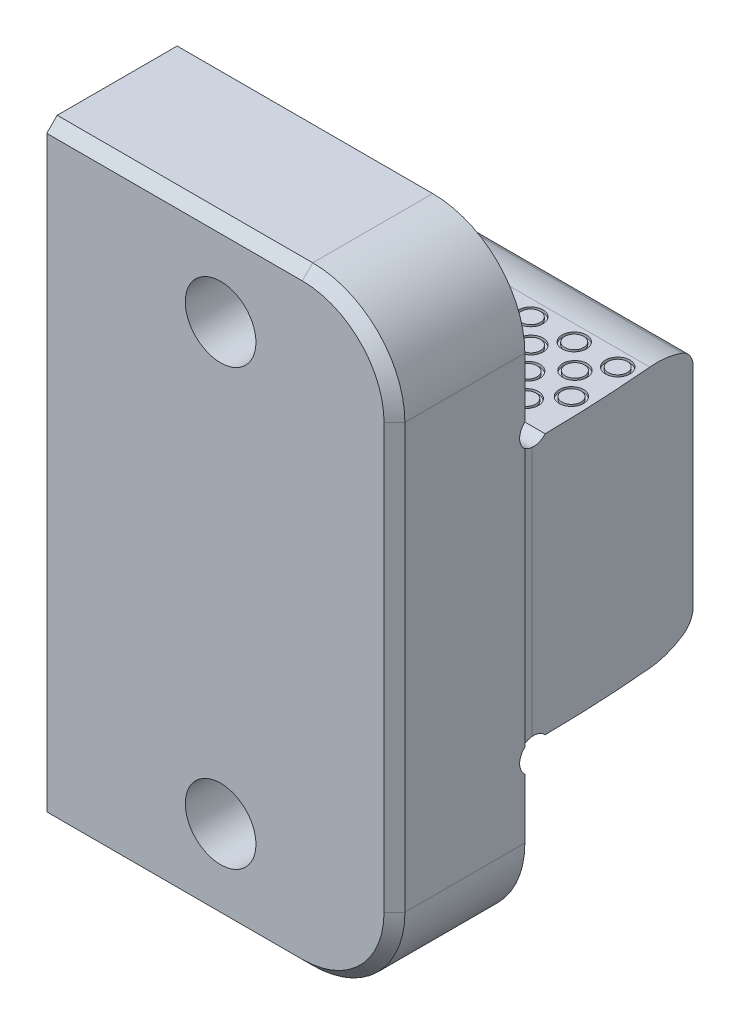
SolidWorks part; units mm, degrees
ref_plane "Front Plane" through (0, 0, 0) normal (0, 0, 1) x (1, 0, 0)
ref_plane "Top Plane" through (0, 0, 0) normal (0, 1, 0) x (1, 0, 0)
ref_plane "Right Plane" through (0, 0, 0) normal (1, 0, 0) x (0, 0, -1)
sketch "Sketch3" plane through (0, 0, 0) normal (1, 0, 0) x (0, 0, -1)
  line L0 (0, 27.94) -> (0, -27.94) construction
  line L1 (-19.05, -44.45) -> (0, -44.45)
  line L2 (-19.05, -44.45) -> (-19.05, 44.45)
  line L3 (-19.05, 44.45) -> (0, 44.45)
  line L4 (26.416, -19.0475) -> (26.416, 19.0475)
  line L6 (0, -44.45) -> (0, -19.0475)
  line L7 (0, -19.0475) -> (26.416, -19.0475)
  line L8 (0, 44.45) -> (0, 19.0475)
  line L9 (0, 19.0475) -> (26.416, 19.0475)
  line L10 (0, 0) -> (50000, 0) construction
  dimension "D1" = 45.466
  dimension "D2" = 19.05
  dimension "D3" = 88.9
  dimension "D4" = 38.0949
extrude "Extrude1" add sketch "Sketch3" along normal mid plane 50.8
sketch "Sketch7" plane through (25.4, 0, 0) normal (1, 0, 0) x (0, 0, -1)
  line L0 (0, 0) -> (50000, 0) construction
  line L1 (0, -25.4) -> (50.8, -25.4)
  line L2 (0, -25.4) -> (0, 25.4)
  line L3 (0, 25.4) -> (50.8, 25.4)
  line L4 (50.8, -25.4) -> (50.8, 25.4)
  line L5 (0, -44.45) -> (0, -19.0475) construction
  dimension "D1" = 50.8
  dimension "D2" = 50.8
extrude "Cut-Extrude3" cut sketch "Sketch7" against normal blind 0.254
sketch "Sketch8" plane through (25.4, 0, 0) normal (1, 0, 0) x (0, 0, -1)
  line L0 (0, 0) -> (50000, 0) construction
  line L1 (0, -44.45) -> (0, 44.45) construction
  line L2 (0, 19.0475) -> (26.416, 19.0475) construction
  circle A0 centre (1.524, 20.5715) radius 2.286
  circle A1 centre (1.524, -20.5715) radius 2.286
  dimension "D1" = 2.286
  dimension "D2" = 0.762
  dimension "D3" = 0.762
extrude "Cut-Extrude4" cut sketch "Sketch8" against normal through all
sketch "Sketch9" plane through (25.4, 0, 0) normal (1, 0, 0) x (0, 0, -1)
  line L0 (3.2279, 19.0475) -> (26.416, 19.0475) construction
  line L1 (26.416, 19.0475) -> (26.416, -19.0475) construction
  line L2 (0, 0) -> (50000, 0) construction
  line L3 (26.416, 15.1022) -> (32.004, 15.1022)
  line L4 (19.304, 19.0475) -> (19.304, 21.4522)
  line L5 (19.304, 21.4522) -> (32.004, 21.4522)
  line L6 (32.004, 15.1022) -> (32.004, 21.4522)
  line L7 (32.004, -15.1022) -> (32.004, -21.4522)
  line L8 (19.304, -21.4522) -> (32.004, -21.4522)
  line L9 (19.304, -19.0475) -> (19.304, -21.4522)
  line L10 (26.416, -15.1022) -> (32.004, -15.1022)
  arc A0 (19.304, 19.0475) -> (24.6514, 17.8668) centre (19.304, 6.3475) cw
  arc A1 (24.6514, 17.8668) -> (26.416, 15.1022) centre (23.368, 15.1022) cw
  arc A2 (24.6514, -17.8668) -> (26.416, -15.1022) centre (23.368, -15.1022) ccw
  arc A3 (19.304, -19.0475) -> (24.6514, -17.8668) centre (19.304, -6.3475) ccw
  dimension "D1" = 3.048
  dimension "D2" = 12.7
  dimension "D3" = 7.112
  dimension "D4" = 6.35
  dimension "D5" = 12.7
extrude "Cut-Extrude5" cut sketch "Sketch9" against normal through all
sketch "Sketch13" plane through (0, 44.45, 0) normal (0, 1, 0) x (1, 0, 0)
  line L0 (25.146, 3.2279) -> (25.146, 19.304) construction
  line L2 (22.6502, 33.02) -> (35.3502, 33.02)
  line L4 (25.146, 1.27) -> (35.3502, 1.27)
  line L5 (35.3502, 33.02) -> (35.3502, 1.27)
  arc A0 (22.6502, 33.02) -> (25.146, 1.27) centre (-178.054, 1.27) cw
  dimension "D1" = 203.2
  dimension "D2" = 1.27
  dimension "D3" = 31.75
  dimension "D4" = 12.7
extrude "Cut-Extrude6" cut sketch "Sketch13" against normal through all
sketch "Sketch15" plane through (0, 19.0475, 0) normal (0, 1, 0) x (1, 0, 0)
  line L0 (-25.4, 19.304) -> (-25.4, 3.2279) construction
  line L1 (-25.4, 0) -> (-25.4, -19.05) construction
  line L2 (25.4, -19.05) -> (-25.4, -19.05) construction
  circle A0 centre (-16.1036, 16.9672) radius 1.778
  circle A1 centre (-16.1036, 16.9672) radius 1.397
  circle A2 centre (-9.7536, 16.9672) radius 1.778
  circle A3 centre (-9.7536, 16.9672) radius 1.397
  circle A4 centre (-22.4536, 16.9672) radius 1.778
  circle A5 centre (-22.4536, 16.9672) radius 1.397
  circle A6 centre (-3.4036, 16.9672) radius 1.778
  circle A7 centre (-3.4036, 16.9672) radius 1.397
  circle A8 centre (2.9464, 16.9672) radius 1.778
  circle A9 centre (2.9464, 16.9672) radius 1.397
  circle A10 centre (9.2964, 16.9672) radius 1.397
  circle A11 centre (9.2964, 16.9672) radius 1.778
  circle A12 centre (15.6464, 16.9672) radius 1.778
  circle A13 centre (15.6464, 16.9672) radius 1.397
  circle A14 centre (21.9964, 16.9672) radius 1.397
  circle A15 centre (21.9964, 16.9672) radius 1.778
  circle A16 centre (-12.827, 13.4112) radius 1.397
  circle A17 centre (-12.827, 13.4112) radius 1.778
  circle A18 centre (-6.4008, 13.4112) radius 1.397
  circle A19 centre (-6.4008, 13.4112) radius 1.778
  circle A20 centre (-19.2532, 13.4112) radius 1.397
  circle A21 centre (-19.2532, 13.4112) radius 1.778
  circle A22 centre (0.0254, 13.4112) radius 1.778
  circle A23 centre (0.0254, 13.4112) radius 1.397
  circle A24 centre (6.4516, 13.4112) radius 1.397
  circle A25 centre (6.4516, 13.4112) radius 1.778
  circle A26 centre (12.8778, 13.4112) radius 1.397
  circle A27 centre (12.8778, 13.4112) radius 1.778
  circle A28 centre (19.304, 13.4112) radius 1.397
  circle A29 centre (19.304, 13.4112) radius 1.778
  circle A32 centre (-16.0528, 9.8552) radius 1.397
  circle A33 centre (-16.0528, 9.8552) radius 1.778
  circle A34 centre (-9.652, 9.8552) radius 1.397
  circle A35 centre (-9.652, 9.8552) radius 1.778
  circle A36 centre (-22.4536, 9.8552) radius 1.397
  circle A37 centre (-22.4536, 9.8552) radius 1.778
  circle A38 centre (-3.2512, 9.8552) radius 1.397
  circle A39 centre (-3.2512, 9.8552) radius 1.778
  circle A40 centre (3.1496, 9.8552) radius 1.397
  circle A41 centre (3.1496, 9.8552) radius 1.778
  circle A42 centre (9.5504, 9.8552) radius 1.778
  circle A43 centre (9.5504, 9.8552) radius 1.397
  circle A44 centre (15.9512, 9.8552) radius 1.397
  circle A45 centre (15.9512, 9.8552) radius 1.778
  circle A46 centre (22.352, 9.8552) radius 1.397
  circle A47 centre (22.352, 9.8552) radius 1.778
  circle A48 centre (-12.827, 6.2992) radius 1.397
  circle A49 centre (-12.827, 6.2992) radius 1.778
  circle A50 centre (-6.4008, 6.2992) radius 1.397
  circle A51 centre (-6.4008, 6.2992) radius 1.778
  circle A52 centre (-19.2532, 6.2992) radius 1.397
  circle A53 centre (-19.2532, 6.2992) radius 1.778
  circle A54 centre (0.0254, 6.2992) radius 1.397
  circle A55 centre (0.0254, 6.2992) radius 1.778
  circle A56 centre (6.4516, 6.2992) radius 1.778
  circle A57 centre (6.4516, 6.2992) radius 1.397
  circle A58 centre (12.8778, 6.2992) radius 1.397
  circle A59 centre (12.8778, 6.2992) radius 1.778
  circle A60 centre (19.304, 6.2992) radius 1.397
  circle A61 centre (19.304, 6.2992) radius 1.778
  dimension "D1" = 2.9464
  dimension "D2" = 6.1468
  dimension "D12" = 3.556
  dimension "D7" = 3.556
  dimension "D8" = 2.794
  dimension "D3" = 6.35
  dimension "D4" = 6.35
  dimension "D5" = 6.35
  dimension "D6" = 6.35
  dimension "D9" = 6.35
  dimension "D10" = 6.35
  dimension "D11" = 6.35
  dimension "D13" = 3.556
  dimension "D14" = 3.556
  dimension "D15" = 36.0172
  dimension "D16" = 6.4262
  dimension "D17" = 6.4262
  dimension "D18" = 6.4262
  dimension "D19" = 6.4262
  dimension "D20" = 6.4262
  dimension "D21" = 6.4262
  dimension "D22" = 6.4008
  dimension "D23" = 6.4008
  dimension "D24" = 6.4008
  dimension "D25" = 6.4008
  dimension "D26" = 6.4008
  dimension "D27" = 6.4008
  dimension "D28" = 6.4008
  dimension "D29" = 6.4262
  dimension "D30" = 6.4262
  dimension "D31" = 6.4262
  dimension "D32" = 6.4262
  dimension "D33" = 6.4262
  dimension "D34" = 6.4262
extrude "Cut-Extrude7" cut sketch "Sketch15" against normal blind 0.381
mirror "Mirror1" about plane through (0, 0, 0) normal (0, 1, 0) of "Cut-Extrude7"
hole_wizard "3/8\"-16 CBORE" positions "Sketch11" profile "Sketch10" counterbore size "3/8" standard "Ansi Inch"
sketch "Sketch11" plane through (0, 0, 0) normal (0, 0, -1) x (-1, 0, 0)
  line L0 (0, 0) -> (0, 50000) construction
  line L1 (0, 0) -> (50000, 0) construction
  point P0 (0, 31.75)
  point P10 (0, -31.75)
  dimension "D1" = 63.5
sketch "Sketch10" plane through (0, 31.75, 0) normal (1, 0, 0) x (0, 1, 0)
  line L0 (0, 0) -> (0, 19.05)
  line L1 (0, 19.05) -> (5.1587, 19.05)
  line L3 (5.1587, 19.05) -> (5.1587, 10.3187)
  line L4 (5.1587, 10.3187) -> (7.9375, 10.3187)
  line L5 (7.9375, 10.3187) -> (7.9375, 0)
  line L7 (7.9375, 0) -> (0, 0)
  line L11 (0, -6.35) -> (0, 107.95) construction
  dimension "Thru Hole Dia." = 10.3175
  dimension "Thru Hole Depth" = 19.05
  dimension "C'Bore Dia." = 15.875
  dimension "C'Bore Depth" = 10.3187
fillet "Fillet1" radius 13.462 2 edges at (25.4, -44.45, 9.525) (25.4, 44.45, 9.525)
chamfer "Chamfer1" distance 1.524 angle 45 5 edges at (-6.731, 44.45, 19.05) (-6.731, -44.45, 19.05) (25.4, 0, 19.05) (21.4571, 40.5071, 19.05) (21.4571, -40.5071, 19.05)
